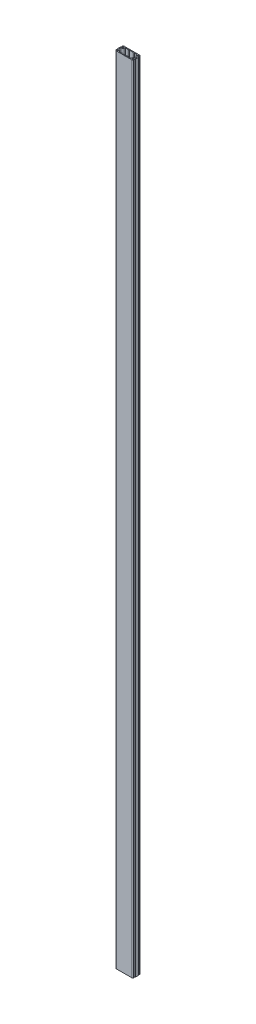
SolidWorks part; units mm, degrees
ref_plane "Alzado" through (0, 0, 0) normal (0, 0, 1) x (1, 0, 0)
ref_plane "Planta" through (0, 0, 0) normal (0, 1, 0) x (1, 0, 0)
ref_plane "Vista lateral" through (0, 0, 0) normal (1, 0, 0) x (0, 0, -1)
sketch "Croquis2" plane through (0, 0, 0) normal (0, 1, 0) x (1, 0, 0)
  line L0 (-183.2758, 0) -> (156.0252, 0) construction
  line L1 (0, 113.0945) -> (0, -113.0945) construction
  line L2 (90, -15.8204) -> (90, 15.8204)
  line L3 (75.5, 40) -> (-75.5, 40)
  line L4 (-17.4827, 32) -> (17.4827, 32)
  line L5 (20, 29) -> (30, 29)
  line L6 (123.5786, 25.5) -> (27.4214, 25.5) construction
  line L7 (75.5, 71.4027) -> (75.5, -20.4027) construction
  line L8 (82, 4.5) -> (82, -4.5)
  line L9 (20, 29) -> (17.4827, 32)
  line L10 (30, 29) -> (32.5173, 32)
  line L11 (32.5173, 32) -> (54.5, 32)
  line L12 (75.5, -71.4027) -> (75.5, 20.4027) construction
  line L13 (123.5786, -25.5) -> (27.4214, -25.5) construction
  line L14 (32.5173, -32) -> (54.5, -32)
  line L15 (30, -29) -> (32.5173, -32)
  line L16 (20, -29) -> (17.4827, -32)
  line L17 (20, -29) -> (30, -29)
  line L18 (-17.4827, -32) -> (17.4827, -32)
  line L19 (75.5, -40) -> (-75.5, -40)
  line L20 (-123.5786, -25.5) -> (-27.4214, -25.5) construction
  line L21 (-75.5, -71.4027) -> (-75.5, 20.4027) construction
  line L22 (-75.5, 71.4027) -> (-75.5, -20.4027) construction
  line L23 (-123.5786, 25.5) -> (-27.4214, 25.5) construction
  line L24 (-20, -29) -> (-30, -29)
  line L25 (-20, -29) -> (-17.4827, -32)
  line L26 (-30, -29) -> (-32.5173, -32)
  line L27 (-32.5173, -32) -> (-54.5, -32)
  line L28 (-32.5173, 32) -> (-54.5, 32)
  line L29 (-30, 29) -> (-32.5173, 32)
  line L30 (-20, 29) -> (-17.4827, 32)
  line L31 (-82, 4.5) -> (-82, -4.5)
  line L32 (-20, 29) -> (-30, 29)
  line L33 (-90, -15.8204) -> (-90, 15.8204)
  arc A0 (88.1963, 32.5039) -> (75.5, 40) centre (75.5, 25.5) ccw
  arc A1 (81.1914, 28.6397) -> (79.722, 20.5579) centre (75.5, 25.5) ccw
  arc A3 (61, 25.5) -> (54.5, 32) centre (54.5, 25.5) ccw
  arc A4 (81.1914, 28.6397) -> (88.1963, 32.5039) centre (84.6939, 30.5718) ccw
  arc A5 (90, 15.8204) -> (79.722, 20.5579) centre (83.7692, 15.8204) ccw
  arc A6 (82, 4.5) -> (75.5, 11) centre (75.5, 4.5) ccw
  arc A7 (61, 25.5) -> (75.5, 11) centre (75.5, 25.5) ccw
  arc A8 (61, -25.5) -> (75.5, -11) centre (75.5, -25.5) cw
  arc A9 (82, -4.5) -> (75.5, -11) centre (75.5, -4.5) cw
  arc A10 (90, -15.8204) -> (79.722, -20.5579) centre (83.7692, -15.8204) cw
  arc A11 (81.1914, -28.6397) -> (88.1963, -32.5039) centre (84.6939, -30.5718) cw
  arc A12 (61, -25.5) -> (54.5, -32) centre (54.5, -25.5) cw
  arc A13 (81.1914, -28.6397) -> (79.722, -20.5579) centre (75.5, -25.5) cw
  arc A14 (88.1963, -32.5039) -> (75.5, -40) centre (75.5, -25.5) cw
  arc A15 (-88.1963, -32.5039) -> (-75.5, -40) centre (-75.5, -25.5) ccw
  arc A16 (-81.1914, -28.6397) -> (-79.722, -20.5579) centre (-75.5, -25.5) ccw
  arc A17 (-61, -25.5) -> (-54.5, -32) centre (-54.5, -25.5) ccw
  arc A18 (-81.1914, -28.6397) -> (-88.1963, -32.5039) centre (-84.6939, -30.5718) ccw
  arc A19 (-90, -15.8204) -> (-79.722, -20.5579) centre (-83.7692, -15.8204) ccw
  arc A20 (-82, -4.5) -> (-75.5, -11) centre (-75.5, -4.5) ccw
  arc A21 (-61, -25.5) -> (-75.5, -11) centre (-75.5, -25.5) ccw
  arc A22 (-61, 25.5) -> (-75.5, 11) centre (-75.5, 25.5) cw
  arc A23 (-82, 4.5) -> (-75.5, 11) centre (-75.5, 4.5) cw
  arc A24 (-90, 15.8204) -> (-79.722, 20.5579) centre (-83.7692, 15.8204) cw
  arc A25 (-81.1914, 28.6397) -> (-88.1963, 32.5039) centre (-84.6939, 30.5718) cw
  arc A26 (-61, 25.5) -> (-54.5, 32) centre (-54.5, 25.5) cw
  arc A27 (-81.1914, 28.6397) -> (-79.722, 20.5579) centre (-75.5, 25.5) cw
  arc A28 (-88.1963, 32.5039) -> (-75.5, 40) centre (-75.5, 25.5) cw
  point P6 (0, 0)
  point P8 (-90, 0)
  point P9 (0, 40)
  point P17 (75.5, 25.5)
  point P20 (75.5, 25.5)
  point P56 (82, 0)
  point P58 (90, 0)
  point P94 (0, -40)
  point P95 (0, -32)
  point P102 (0, 32)
  point P103 (-82, 0)
  dimension "D5" = 14.5
  dimension "D6" = 6.5
  dimension "D7" = 6.2308
  dimension "D8" = 9.1939
  dimension "D1" = 90
  dimension "D2" = 40
  dimension "D3" = 8
  dimension "D4" = 8
  dimension "D9" = 21
  dimension "D10" = 10
  dimension "D11" = 20
  dimension "D12" = 3
  dimension "D13" = 50
  dimension "D14" = 50
extrude "Saliente-Extruir1" add sketch "Croquis2" along normal blind 7940
